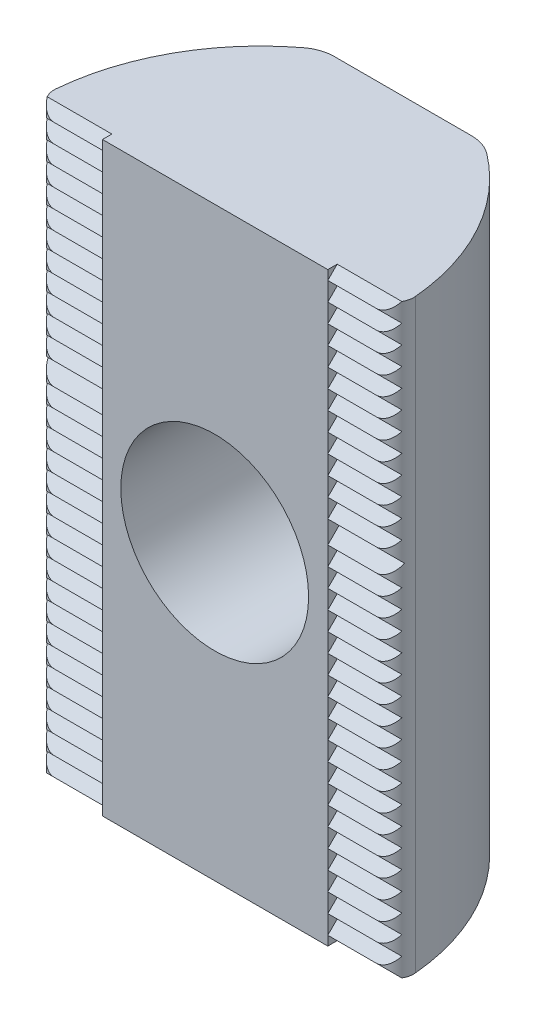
SolidWorks part; units mm, degrees
ref_plane "正面" through (0, 0, 0) normal (0, 0, 1) x (1, 0, 0)
ref_plane "平面" through (0, 0, 0) normal (0, 1, 0) x (1, 0, 0)
ref_plane "右側面" through (0, 0, 0) normal (1, 0, 0) x (0, 0, -1)
sketch "ｽｹｯﾁ1" plane through (0, 0, 0) normal (0, -1, 0) x (1, 0, 0)
  line L8 (-4.2884, 0) -> (4.2884, 0)
  line L9 (1.8306, -5) -> (-1.8306, -5)
  arc A8 (-4.7865, -0.544) -> (-2.4348, -4.7969) centre (1.1902, -0.0157) ccw
  arc A9 (-2.4348, -4.7969) -> (-1.8306, -5) centre (-1.8306, -4) ccw
  arc A10 (-4.2884, 0) -> (-4.7865, -0.544) centre (-4.2884, -0.5) ccw
  arc A11 (2.4348, -4.7969) -> (4.7865, -0.544) centre (-1.1902, -0.0157) ccw
  arc A12 (1.8306, -5) -> (2.4348, -4.7969) centre (1.8306, -4) ccw
  arc A13 (4.7865, -0.544) -> (4.2884, 0) centre (4.2884, -0.5) ccw
extrude "押し出し1" add sketch "ｽｹｯﾁ1" along normal mid plane 15.6
hole_wizard "M6x1.0 ねじ穴1" positions "ｽｹｯﾁ3" profile "ｽｹｯﾁ2" tap size "M6x1.0" standard "JIS"
sketch "ｽｹｯﾁ3" plane through (1.3374, 5.2145, 0) normal (0, 0, 1) x (1, 0, 0)
  line L1 (2.951, -13.0145) -> (-5.6258, -13.0145) construction
  line L3 (2.951, -13.0145) -> (2.951, 2.5855) construction
  point P0 (-1.349, -5.2145)
  dimension "D1" = 7.8
  dimension "D2" = 4.3
sketch "ｽｹｯﾁ2" plane through (-0.0116, 0, 0) normal (1, 0, 0) x (0, -1, 0)
  line L0 (0, 0) -> (0, 5)
  line L1 (0, 5) -> (2.5, 5)
  line L2 (2.5, 5) -> (2.5, 0)
  line L5 (2.5, 0) -> (0, 0)
  line L11 (0, -6.35) -> (0, 107.95) construction
  dimension "次ｻｰﾌｪｽまでのねじ下穴ﾄﾞﾘﾙの直径" = 5
  dimension "次ｻｰﾌｪｽまでのねじ下穴ﾄﾞﾘﾙの深さ" = 5
ref_plane "平面1" through (3, 0, 0) normal (1, 0, 0) x (0, 0, -1)
ref_plane "平面2" through (-3, 0, 0) normal (1, 0, 0) x (0, 0, -1)
sketch "ｽｹｯﾁ4" plane through (3, 0, 0) normal (1, 0, 0) x (0, 0, -1)
  line L0 (0.25, -7.8) -> (-2.0124, -7.8)
  line L1 (-2.0124, -7.8) -> (-2.0124, 7.8)
  line L2 (-2.0124, 7.8) -> (0.25, 7.8)
  line L3 (0, -7.05) -> (0.25, -6.8)
  line L6 (0.25, -7.3) -> (0, -7.05)
  line L7 (0.25, -7.8) -> (0, -7.55)
  line L8 (0, -7.55) -> (0.25, -7.3)
  line L9 (0, 4.55) -> (0.25, 4.8)
  line L10 (0.25, -1.3) -> (0, -1.05)
  line L13 (0.25, -4.3) -> (0, -4.05)
  line L14 (0, -6.55) -> (0.25, -6.3)
  line L15 (0.25, -6.8) -> (0, -6.55)
  line L16 (0, -4.55) -> (0.25, -4.3)
  line L17 (0.25, -5.3) -> (0, -5.05)
  line L18 (0, -6.05) -> (0.25, -5.8)
  line L19 (0.25, -6.3) -> (0, -6.05)
  line L20 (0.25, -5.8) -> (0, -5.55)
  line L21 (0, -5.55) -> (0.25, -5.3)
  line L22 (0, -5.05) -> (0.25, -4.8)
  line L23 (0.25, -4.8) -> (0, -4.55)
  line L24 (0, -2.55) -> (0.25, -2.3)
  line L25 (0.25, -3.3) -> (0, -3.05)
  line L26 (0, -4.05) -> (0.25, -3.8)
  line L27 (0.25, -3.8) -> (0, -3.55)
  line L28 (0, -3.55) -> (0.25, -3.3)
  line L29 (0, -3.05) -> (0.25, -2.8)
  line L30 (0.25, -2.8) -> (0, -2.55)
  line L31 (0, -2.05) -> (0.25, -1.8)
  line L32 (0.25, -2.3) -> (0, -2.05)
  line L33 (0.25, -1.8) -> (0, -1.55)
  line L34 (0, -1.55) -> (0.25, -1.3)
  line L37 (0, -0.55) -> (0.25, -0.3)
  line L38 (0, -1.05) -> (0.25, -0.8)
  line L39 (0.25, -0.8) -> (0, -0.55)
  line L40 (0, 1.45) -> (0.3, 1.75)
  line L41 (0.25, 0.7) -> (0, 0.95)
  line L42 (0, -0.05) -> (0.25, 0.2)
  line L43 (0.25, -0.3) -> (0, -0.05)
  line L44 (0.25, 0.2) -> (0, 0.45)
  line L45 (0, 0.45) -> (0.25, 0.7)
  line L46 (0, 0.95) -> (0.25, 1.2)
  line L47 (0.25, 1.2) -> (0, 1.45)
  line L48 (0, 3.55) -> (0.25, 3.8)
  line L49 (0.25, 2.8) -> (0, 3.05)
  line L50 (0, 2.05) -> (0.25, 2.3)
  line L51 (0.3, 1.75) -> (0, 2.05)
  line L52 (0.25, 2.3) -> (0, 2.55)
  line L53 (0, 2.55) -> (0.25, 2.8)
  line L54 (0, 3.05) -> (0.25, 3.3)
  line L55 (0.25, 3.3) -> (0, 3.55)
  line L56 (0, 4.05) -> (0.25, 4.3)
  line L57 (0.25, 3.8) -> (0, 4.05)
  line L58 (0.25, 4.3) -> (0, 4.55)
  line L60 (0.25, 7.3) -> (0, 7.55)
  line L61 (0, 5.55) -> (0.25, 5.8)
  line L62 (0.25, 4.8) -> (0, 5.05)
  line L63 (0, 5.05) -> (0.25, 5.3)
  line L64 (0.25, 5.3) -> (0, 5.55)
  line L65 (0, 7.05) -> (0.25, 7.3)
  line L66 (0.25, 6.8) -> (0, 7.05)
  line L67 (0.25, 6.3) -> (0, 6.55)
  line L68 (0, 6.55) -> (0.25, 6.8)
  line L69 (0.25, 5.8) -> (0, 6.05)
  line L70 (0, 6.05) -> (0.25, 6.3)
  line L71 (0, 7.55) -> (0.25, 7.8)
extrude "押し出し2" cut sketch "ｽｹｯﾁ4" along normal through all contours L60 L71 L2 L1 L0 L7 L8 L6 L3 L15 L14 L19 L18 L20 L21 L17 L22 L23 L16 L13 L26 L27 L28 L25 L29 L30 L24 L32 L31 L33 L34 L10 L38 L39 L37 L43 L42 L44 L45 L41 L46 L47 L40 L51 L50 L52 L53 L49 L54 L55 L48
sketch "ｽｹｯﾁ5" plane through (-3, 0, 0) normal (1, 0, 0) x (0, 0, -1)
  line L1 (-2.0124, 7.8) -> (0.25, 7.8) construction
  line L2 (-2.0124, -7.8) -> (-2.0124, 7.8) construction
  line L3 (0.25, -7.8) -> (-2.0124, -7.8) construction
  line L4 (0.25, -7.8) -> (0, -7.55) construction
  line L5 (0, -7.55) -> (0.25, -7.3) construction
  line L6 (0.25, -7.3) -> (0, -7.05) construction
  line L7 (0, -7.05) -> (0.25, -6.8) construction
  line L8 (0.25, -6.8) -> (0, -6.55) construction
  line L9 (0, -6.55) -> (0.25, -6.3) construction
  line L10 (0.25, -6.3) -> (0, -6.05) construction
  line L11 (0, -6.05) -> (0.25, -5.8) construction
  line L12 (0.25, -5.8) -> (0, -5.55) construction
  line L13 (0, -5.55) -> (0.25, -5.3) construction
  line L14 (0.25, -5.3) -> (0, -5.05) construction
  line L15 (0, -5.05) -> (0.25, -4.8) construction
  line L16 (0.25, -4.8) -> (0, -4.55) construction
  line L17 (0, -4.55) -> (0.25, -4.3) construction
  line L18 (0.25, -4.3) -> (0, -4.05) construction
  line L19 (0, -4.05) -> (0.25, -3.8) construction
  line L20 (0.25, -3.8) -> (0, -3.55) construction
  line L21 (0, -3.55) -> (0.25, -3.3) construction
  line L22 (0.25, -3.3) -> (0, -3.05) construction
  line L23 (0, -3.05) -> (0.25, -2.8) construction
  line L24 (0.25, -2.8) -> (0, -2.55) construction
  line L25 (0, -2.55) -> (0.25, -2.3) construction
  line L26 (0.25, -2.3) -> (0, -2.05) construction
  line L27 (0, -2.05) -> (0.25, -1.8) construction
  line L28 (0.25, -1.8) -> (0, -1.55) construction
  line L29 (0, -1.55) -> (0.25, -1.3) construction
  line L30 (0.25, -1.3) -> (0, -1.05) construction
  line L31 (0, -1.05) -> (0.25, -0.8) construction
  line L32 (0.25, -0.8) -> (0, -0.55) construction
  line L33 (0, -0.55) -> (0.25, -0.3) construction
  line L34 (0.25, -0.3) -> (0, -0.05) construction
  line L35 (0, -0.05) -> (0.25, 0.2) construction
  line L36 (0.25, 0.2) -> (0, 0.45) construction
  line L37 (0, 0.45) -> (0.25, 0.7) construction
  line L38 (0.25, 0.7) -> (0, 0.95) construction
  line L39 (0, 0.95) -> (0.25, 1.2) construction
  line L40 (0.25, 1.2) -> (0, 1.45) construction
  line L41 (0, 1.45) -> (0.3, 1.75) construction
  line L42 (0.3, 1.75) -> (0, 2.05) construction
  line L43 (0, 2.05) -> (0.25, 2.3) construction
  line L44 (0.25, 2.3) -> (0, 2.55) construction
  line L45 (0, 2.55) -> (0.25, 2.8) construction
  line L46 (0.25, 2.8) -> (0, 3.05) construction
  line L47 (0, 3.05) -> (0.25, 3.3) construction
  line L48 (0.25, 3.3) -> (0, 3.55) construction
  line L49 (0, 3.55) -> (0.25, 3.8) construction
  line L50 (0.25, 3.8) -> (0, 4.05) construction
  line L51 (0, 4.05) -> (0.25, 4.3) construction
  line L52 (0.25, 4.3) -> (0, 4.55) construction
  line L53 (0, 4.55) -> (0.25, 4.8) construction
  line L54 (0.25, 4.8) -> (0, 5.05) construction
  line L55 (0, 5.05) -> (0.25, 5.3) construction
  line L56 (0.25, 5.3) -> (0, 5.55) construction
  line L57 (0, 5.55) -> (0.25, 5.8) construction
  line L58 (0.25, 5.8) -> (0, 6.05) construction
  line L59 (0, 6.05) -> (0.25, 6.3) construction
  line L60 (0.25, 6.3) -> (0, 6.55) construction
  line L61 (0, 6.55) -> (0.25, 6.8) construction
  line L62 (0.25, 6.8) -> (0, 7.05) construction
  line L63 (0, 7.05) -> (0.25, 7.3) construction
  line L64 (0.25, 7.3) -> (0, 7.55) construction
  line L65 (0, 7.55) -> (0.25, 7.8) construction
  line L67 (-2.0124, 7.8) -> (0.25, 7.8)
  line L68 (-2.0124, -7.8) -> (-2.0124, 7.8)
  line L69 (0.25, -7.8) -> (-2.0124, -7.8)
  line L70 (0.25, -7.8) -> (0, -7.55)
  line L71 (0, -7.55) -> (0.25, -7.3)
  line L72 (0.25, -7.3) -> (0, -7.05)
  line L73 (0, -7.05) -> (0.25, -6.8)
  line L74 (0.25, -6.8) -> (0, -6.55)
  line L75 (0, -6.55) -> (0.25, -6.3)
  line L76 (0.25, -6.3) -> (0, -6.05)
  line L77 (0, -6.05) -> (0.25, -5.8)
  line L78 (0.25, -5.8) -> (0, -5.55)
  line L79 (0, -5.55) -> (0.25, -5.3)
  line L80 (0.25, -5.3) -> (0, -5.05)
  line L81 (0, -5.05) -> (0.25, -4.8)
  line L82 (0.25, -4.8) -> (0, -4.55)
  line L83 (0, -4.55) -> (0.25, -4.3)
  line L84 (0.25, -4.3) -> (0, -4.05)
  line L85 (0, -4.05) -> (0.25, -3.8)
  line L86 (0.25, -3.8) -> (0, -3.55)
  line L87 (0, -3.55) -> (0.25, -3.3)
  line L88 (0.25, -3.3) -> (0, -3.05)
  line L89 (0, -3.05) -> (0.25, -2.8)
  line L90 (0.25, -2.8) -> (0, -2.55)
  line L91 (0, -2.55) -> (0.25, -2.3)
  line L92 (0.25, -2.3) -> (0, -2.05)
  line L93 (0, -2.05) -> (0.25, -1.8)
  line L94 (0.25, -1.8) -> (0, -1.55)
  line L95 (0, -1.55) -> (0.25, -1.3)
  line L96 (0.25, -1.3) -> (0, -1.05)
  line L97 (0, -1.05) -> (0.25, -0.8)
  line L98 (0.25, -0.8) -> (0, -0.55)
  line L99 (0, -0.55) -> (0.25, -0.3)
  line L100 (0.25, -0.3) -> (0, -0.05)
  line L101 (0, -0.05) -> (0.25, 0.2)
  line L102 (0.25, 0.2) -> (0, 0.45)
  line L103 (0, 0.45) -> (0.25, 0.7)
  line L104 (0.25, 0.7) -> (0, 0.95)
  line L105 (0, 0.95) -> (0.25, 1.2)
  line L106 (0.25, 1.2) -> (0, 1.45)
  line L107 (0, 1.45) -> (0.3, 1.75)
  line L108 (0.3, 1.75) -> (0, 2.05)
  line L109 (0, 2.05) -> (0.25, 2.3)
  line L110 (0.25, 2.3) -> (0, 2.55)
  line L111 (0, 2.55) -> (0.25, 2.8)
  line L112 (0.25, 2.8) -> (0, 3.05)
  line L113 (0, 3.05) -> (0.25, 3.3)
  line L114 (0.25, 3.3) -> (0, 3.55)
  line L115 (0, 3.55) -> (0.25, 3.8)
  line L116 (0.25, 3.8) -> (0, 4.05)
  line L117 (0, 4.05) -> (0.25, 4.3)
  line L118 (0.25, 4.3) -> (0, 4.55)
  line L119 (0, 4.55) -> (0.25, 4.8)
  line L120 (0.25, 4.8) -> (0, 5.05)
  line L121 (0, 5.05) -> (0.25, 5.3)
  line L122 (0.25, 5.3) -> (0, 5.55)
  line L123 (0, 5.55) -> (0.25, 5.8)
  line L124 (0.25, 5.8) -> (0, 6.05)
  line L125 (0, 6.05) -> (0.25, 6.3)
  line L126 (0.25, 6.3) -> (0, 6.55)
  line L127 (0, 6.55) -> (0.25, 6.8)
  line L128 (0.25, 6.8) -> (0, 7.05)
  line L129 (0, 7.05) -> (0.25, 7.3)
  line L130 (0.25, 7.3) -> (0, 7.55)
  line L131 (0, 7.55) -> (0.25, 7.8)
extrude "押し出し3" cut sketch "ｽｹｯﾁ5" against normal through all contours L130 L131 L67 L68 L69 L70 L71 L72 L73 L74 L75 L76 L77 L78 L79 L80 L81 L82 L83 L84 L85 L86 L87 L88 L89 L90 L91 L92 L93 L94 L95 L96 L97 L98 L99 L100 L101 L102 L103 L104 L105 L106 L107 L108 L109 L110 L111 L112 L113 L114 L115
